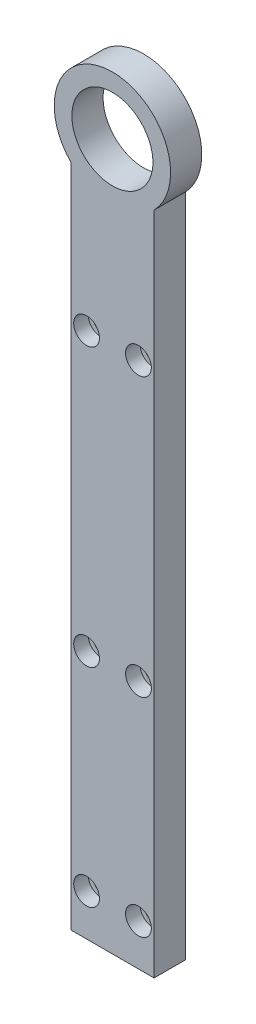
SolidWorks part; units mm, degrees
ref_plane "Front Plane" through (0, 0, 0) normal (0, 0, 1) x (1, 0, 0)
ref_plane "Top Plane" through (0, 0, 0) normal (0, 1, 0) x (1, 0, 0)
ref_plane "Right Plane" through (0, 0, 0) normal (1, 0, 0) x (0, 0, -1)
sketch "Sketch1" plane through (0, 0, 0) normal (0, 0, 1) x (1, 0, 0)
  line L2 (-12.6684, -12.4756) -> (-12.6684, -215.6111)
  line L3 (-12.6684, -215.6111) -> (12.7316, -215.6111)
  line L4 (12.7316, -12.4111) -> (12.7316, -215.6111)
  circle A0 centre (0, 0) radius 12.3825
  arc A1 (12.7316, -12.4111) -> (-12.6684, -12.4756) centre (0, 0) ccw
  circle A2 centre (-7.8932, -54.6142) radius 2.4765
  circle A3 centre (-7.8932, -202.9111) radius 2.4765
  circle A4 centre (7.9564, -202.9111) radius 2.4765
  circle A5 centre (7.9564, -54.5497) radius 2.4765
  circle A6 centre (-7.8932, -139.4111) radius 2.4765
  circle A7 centre (7.9691, -139.4111) radius 2.4765
  dimension "D1" = 24.765
  dimension "D2" = 215.6111
  dimension "D4" = 25.4
  dimension "D14" = 4.953
  dimension "D15" = 4.953
  dimension "D16" = 4.953
  dimension "D19" = 4.953
  dimension "D21" = 4.953
  dimension "D23" = 4.953
  dimension "D3" = 17.78
  dimension "D5" = 203.2
  dimension "D7" = 42.1386
  dimension "D8" = 42.1386
  dimension "D9" = 4.7752
  dimension "D10" = 4.7752
  dimension "D11" = 4.7752
  dimension "D12" = 12.7
  dimension "D13" = 12.7
  dimension "D17" = 76.2
  dimension "D18" = 76.2
  dimension "D20" = 4.7625
  dimension "D22" = 4.7752
  dimension "D24" = 4.7752
extrude "Boss-Extrude1" add sketch "Sketch1" along normal blind 9.525
sketch "Sketch2" plane through (0, 0, 9.525) normal (0, 0, 1) x (1, 0, 0)
  circle A6 centre (-7.8932, -54.6142) radius 3.937
  circle A7 centre (7.9564, -54.5497) radius 3.937
  circle A8 centre (-7.8932, -139.4111) radius 3.937
  circle A9 centre (7.9691, -139.4111) radius 3.937
  circle A10 centre (-7.8932, -202.9111) radius 3.937
  circle A11 centre (7.9564, -202.9111) radius 3.937
  point P1 (5.5516, -158.5642)
  point P2 (-7.8424, -202.9111)
  point P4 (7.9056, -202.9111)
  point P5 (-7.8424, -139.4111)
  point P7 (7.9056, -139.4111)
  point P9 (-7.9059, -54.6142)
  point P11 (7.9056, -54.5497)
  dimension "D2" = 7.874
  dimension "D8" = 7.874
  dimension "D9" = 7.874
  dimension "D10" = 7.874
  dimension "D11" = 7.874
  dimension "D12" = 7.874
extrude "Cut-Extrude1" cut sketch "Sketch2" against normal blind 4.445
